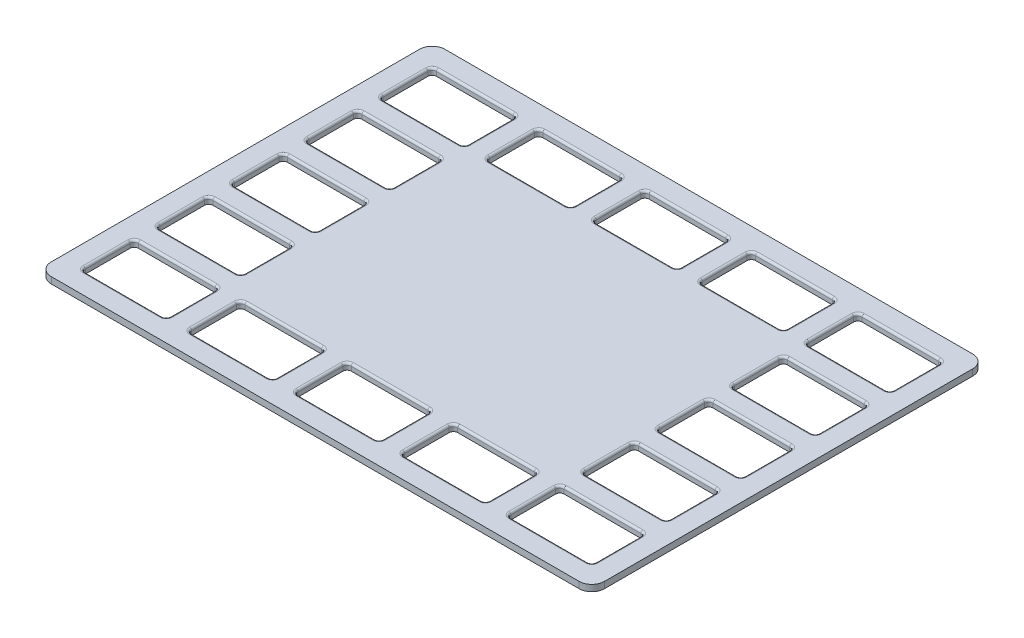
SolidWorks part; units mm, degrees
ref_plane "Front" through (0, 0, 0) normal (0, 0, 1) x (1, 0, 0)
ref_plane "Top" through (0, 0, 0) normal (0, 1, 0) x (1, 0, 0)
ref_plane "Right" through (0, 0, 0) normal (1, 0, 0) x (0, 0, -1)
sketch "Sketch1" plane through (0, 0, 0) normal (0, 1, 0) x (1, 0, 0)
  line L1 (0, 0) -> (260, 0)
  line L2 (0, 0) -> (0, 185)
  line L3 (0, 185) -> (260, 185)
  line L4 (260, 0) -> (260, 185)
  dimension "D1" = 260
  dimension "D2" = 185
extrude "Extrude1" add sketch "Sketch1" along normal blind 3
fillet "Fillet3" radius 6 4 edges at (0, 1.5, -185) (260, 1.5, -185) (260, 1.5, 0) (0, 1.5, 0)
sketch "Sketch2" plane through (0, 3, 0) normal (0, 1, 0) x (-1, 0, 0)
  line L0 (0, -179) -> (0, -6) construction
  line L1 (-10, -10) -> (-50, -10)
  line L2 (-10, -10) -> (-10, -35)
  line L3 (-10, -35) -> (-50, -35)
  line L4 (-50, -10) -> (-50, -35)
  line L5 (-6, 0) -> (-254, 0) construction
  dimension "D1" = 10
  dimension "D2" = 10
  dimension "D3" = 40
  dimension "D4" = 25
extrude "Cut-Extrude1" cut sketch "Sketch2" against normal through all
fillet "Fillet1" radius 2 4 edges at (50, 1.5, -35) (50, 1.5, -10) (10, 1.5, -10) (10, 1.5, -35)
fillet "Fillet2" radius 1 8 edges at (10.5858, 3, -10.5858) (10, 3, -22.5) (10.5858, 3, -34.4142) (30, 3, -35) (49.4142, 3, -34.4142) (50, 3, -22.5) (49.4142, 3, -10.5858) (30, 3, -10)
pattern_linear "LPattern1" count 5 spacing 50 along (1, 0, 0) count 5 spacing 35 along (0, 0, -1) of "Cut-Extrude1", "Fillet1", "Fillet2"
